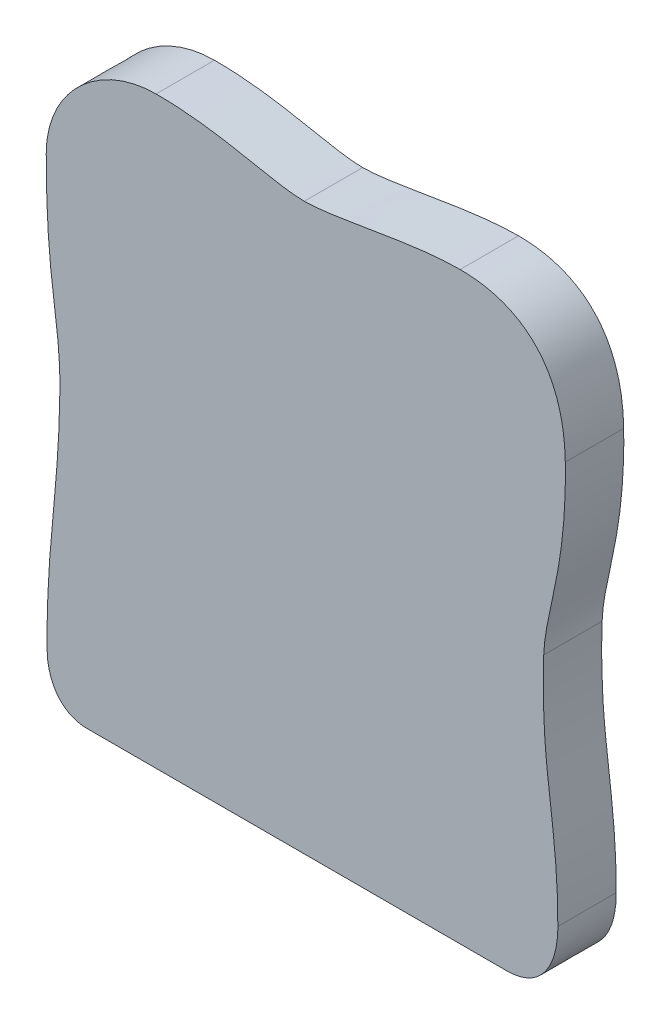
SolidWorks part; units mm, degrees
ref_plane "Front Plane" through (0, 0, 0) normal (0, 0, 1) x (1, 0, 0)
ref_plane "Top Plane" through (0, 0, 0) normal (0, 1, 0) x (1, 0, 0)
ref_plane "Right Plane" through (0, 0, 0) normal (1, 0, 0) x (0, 0, -1)
sketch "Sketch1" plane through (0, 0, 0) normal (0, 0, 1) x (1, 0, 0)
  line L0 (30.8796, -45.0294) -> (-33.7517, -45.0294)
  spline S0 degree 3 poles (-33.7517, -45.0294) (-37.7807, -45.0294) (-39.8581, -41.5785) (-39.8965, -37.6616) knots 0.090909 0.090909 0.090909 0.090909 0.181818 0.181818 0.181818 0.181818
  spline S1 degree 3 poles (-39.8965, -37.6616) (-40.0393, -23.0213) (-38.1191, -16.3179) (-37.939, -2.2074) knots 0.181818 0.181818 0.181818 0.181818 0.272727 0.272727 0.272727 0.272727
  spline S2 degree 3 poles (-37.939, -2.2074) (-37.8092, 7.9617) (-40.0393, 10.4926) (-40.0393, 28.5283) knots 0.272727 0.272727 0.272727 0.272727 0.363636 0.363636 0.363636 0.363636
  spline S3 degree 3 poles (-40.0393, 28.5283) (-40.0393, 37.5714) (-31.874, 44.9565) (-23.1146, 44.9706) knots 0.363636 0.363636 0.363636 0.363636 0.454545 0.454545 0.454545 0.454545
  spline S4 degree 3 poles (-23.1146, 44.9706) (-12.9085, 44.9868) (-5.2472, 42.0662) (-0.2786, 42.0662) knots 0.454545 0.454545 0.454545 0.454545 0.545455 0.545455 0.545455 0.545455
  spline S5 degree 3 poles (-0.2786, 42.0662) (4.6899, 42.0662) (15.9342, 44.9632) (23.7397, 44.9706) knots 0.545455 0.545455 0.545455 0.545455 0.636364 0.636364 0.636364 0.636364
  spline S6 degree 3 poles (23.7397, 44.9706) (33.1735, 44.9798) (39.7472, 39.5121) (39.9479, 27.3744) knots 0.636364 0.636364 0.636364 0.636364 0.727273 0.727273 0.727273 0.727273
  spline S7 degree 3 poles (39.9479, 27.3744) (40.1924, 12.6092) (36.8437, 6.4049) (36.6205, -0.0294) knots 0.727273 0.727273 0.727273 0.727273 0.818182 0.818182 0.818182 0.818182
  spline S8 degree 3 poles (36.6205, -0.0294) (36.0763, -15.728) (38.7977, -20.9047) (38.798, -35.1696) knots 0.818182 0.818182 0.818182 0.818182 0.909091 0.909091 0.909091 0.909091
  spline S9 degree 3 poles (38.798, -35.1696) (38.7984, -40.487) (36.349, -45.0294) (30.8796, -45.0294) knots 0.909091 0.909091 0.909091 0.909091 1 1 1 1
extrude "Boss-Extrude1" add sketch "Sketch1" along normal mid plane 9
